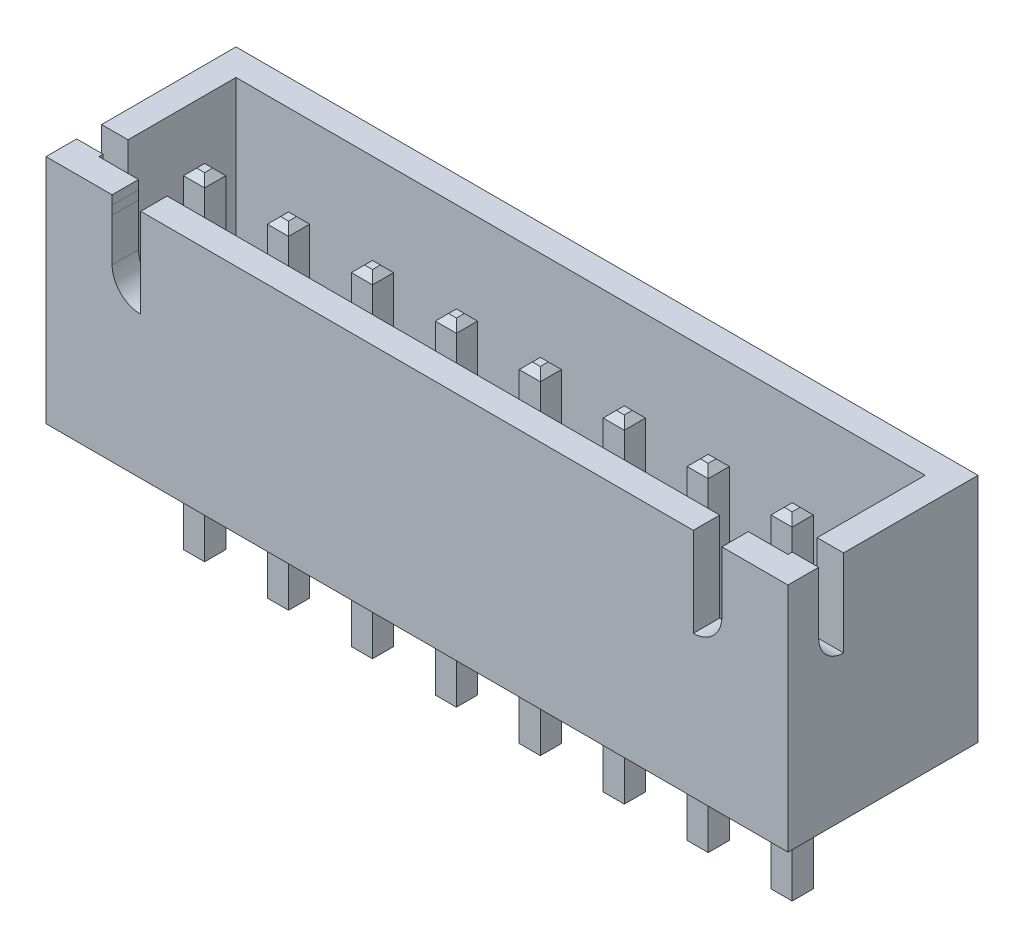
SolidWorks part; units mm, degrees
other "Camera1"
ref_plane "Front Plane" through (0, 0, 0) normal (0, 0, 1) x (1, 0, 0)
ref_plane "Top Plane" through (0, 0, 0) normal (0, 1, 0) x (1, 0, 0)
ref_plane "Right Plane" through (0, 0, 0) normal (1, 0, 0) x (0, 0, -1)
sketch "Sketch1" plane through (0, 0, 0) normal (0, 1, 0) x (1, 0, 0)
  line L1 (-11.2268, 2.875) -> (11.2268, 2.875)
  line L2 (-11.2268, 2.875) -> (-11.2268, -2.875)
  line L3 (-11.2268, -2.875) -> (11.2268, -2.875)
  line L4 (11.2268, 2.875) -> (11.2268, -2.875)
  line L5 (-11.2268, 2.875) -> (11.2268, -2.875) construction
  line L6 (-11.2268, -2.875) -> (11.2268, 2.875) construction
  point P0 (0, 0)
  dimension "D1" = 5.75
  dimension "D2" = 22.4536
extrude "Boss-Extrude1" add sketch "Sketch1" along normal blind 7
shell "Shell1" thickness 0.8
sketch "Sketch2" plane through (11.2268, 0, 0) normal (1, 0, 0) x (0, 0, -1)
  line L0 (-1.193, 7) -> (-1.193, 4.3796)
  line L1 (-2.875, 7) -> (2.875, 7) construction
  line L2 (-1.9469, 5.1335) -> (-1.9469, 7)
  line L3 (-1.9469, 7) -> (-1.193, 7)
  arc A0 (-1.193, 4.3796) -> (-1.9469, 5.1335) centre (-1.193, 5.1335) cw
extrude "Cut-Extrude1" cut sketch "Sketch2" against normal through all
sketch "Sketch3" plane through (0, 0, 2.875) normal (0, 0, 1) x (1, 0, 0)
  line L0 (-9.2268, 7) -> (-9.2268, 6.7289)
  line L1 (-11.2268, 7) -> (11.2268, 7) construction
  line L2 (-9.2268, 6.7289) -> (-9.2273, 6.7289)
  line L3 (-9.2273, 6.7289) -> (-9.2268, 6.4639)
  line L4 (-9.2268, 6.4639) -> (-9.2268, 5.1663)
  line L5 (-8.3606, 4.3001) -> (-8.3606, 7)
  line L6 (-8.3606, 7) -> (-9.2268, 7)
  line L7 (-11.2268, 7) -> (-11.2268, 0) construction
  line L8 (0, 7) -> (0, 0) construction
  line L9 (8.3606, 7) -> (9.2268, 7)
  line L10 (8.3606, 4.3001) -> (8.3606, 7)
  line L11 (9.2268, 6.4639) -> (9.2268, 5.1663)
  line L12 (9.2273, 6.7289) -> (9.2268, 6.4639)
  line L13 (9.2268, 6.7289) -> (9.2273, 6.7289)
  line L14 (9.2268, 7) -> (9.2268, 6.7289)
  arc A0 (-9.2268, 5.1663) -> (-8.3606, 4.3001) centre (-8.3606, 5.1663) ccw
  arc A1 (9.2268, 5.1663) -> (8.3606, 4.3001) centre (8.3606, 5.1663) cw
  point P23 (9.2268, 7.6815)
  point P24 (0, 0)
  point P25 (9.2273, 6.4639)
  dimension "D1" = 2
extrude "Cut-Extrude2" cut sketch "Sketch3" against normal up to next
sketch "Sketch4" plane through (0, 0, 0) normal (0, -1, 0) x (1, 0, 0)
  line L0 (-11.2268, -2.875) -> (-11.2268, 2.875) construction
  line L1 (-9.0968, 0.845) -> (-8.4568, 0.845)
  line L2 (-9.0968, 0.845) -> (-9.0968, 0.205)
  line L3 (-9.0968, 0.205) -> (-8.4568, 0.205)
  line L4 (-8.4568, 0.845) -> (-8.4568, 0.205)
  line L5 (-9.0968, 0.845) -> (-8.4568, 0.205) construction
  line L6 (-9.0968, 0.205) -> (-8.4568, 0.845) construction
  line L7 (-6.5568, 0.205) -> (-5.9168, 0.205)
  line L8 (-5.9168, 0.845) -> (-5.9168, 0.205)
  line L9 (-11.2268, 2.875) -> (11.2268, 2.875) construction
  line L10 (-6.5568, 0.845) -> (-5.9168, 0.845)
  line L11 (-6.5568, 0.845) -> (-6.5568, 0.205)
  line L12 (-4.0168, 0.205) -> (-3.3768, 0.205)
  line L13 (-3.3768, 0.845) -> (-3.3768, 0.205)
  line L14 (-4.0168, 0.845) -> (-3.3768, 0.845)
  line L15 (-4.0168, 0.845) -> (-4.0168, 0.205)
  line L16 (-1.4768, 0.205) -> (-0.8368, 0.205)
  line L17 (-0.8368, 0.845) -> (-0.8368, 0.205)
  line L18 (-1.4768, 0.845) -> (-0.8368, 0.845)
  line L19 (-1.4768, 0.845) -> (-1.4768, 0.205)
  line L20 (1.0632, 0.205) -> (1.7032, 0.205)
  line L21 (1.7032, 0.845) -> (1.7032, 0.205)
  line L22 (1.0632, 0.845) -> (1.7032, 0.845)
  line L23 (1.0632, 0.845) -> (1.0632, 0.205)
  line L24 (3.6032, 0.205) -> (4.2432, 0.205)
  line L25 (4.2432, 0.845) -> (4.2432, 0.205)
  line L26 (3.6032, 0.845) -> (4.2432, 0.845)
  line L27 (3.6032, 0.845) -> (3.6032, 0.205)
  line L28 (6.1432, 0.205) -> (6.7832, 0.205)
  line L29 (6.7832, 0.845) -> (6.7832, 0.205)
  line L30 (6.1432, 0.845) -> (6.7832, 0.845)
  line L31 (6.1432, 0.845) -> (6.1432, 0.205)
  line L32 (8.6832, 0.205) -> (9.3232, 0.205)
  line L33 (9.3232, 0.845) -> (9.3232, 0.205)
  line L34 (8.6832, 0.845) -> (9.3232, 0.845)
  line L35 (8.6832, 0.845) -> (8.6832, 0.205)
  line L40 (11.2232, 0.205) -> (11.8632, 0.205)
  line L41 (11.8632, 0.845) -> (11.8632, 0.205)
  line L42 (11.2232, 0.845) -> (11.8632, 0.845)
  line L43 (11.2232, 0.845) -> (11.2232, 0.205)
  point P0 (-8.7768, 0.525)
  dimension "D1" = 0.64
  dimension "D2" = 0.64
  dimension "D3" = 2.45
  dimension "D4" = 2.35
  dimension "D5" = 9
extrude "Boss-Extrude2" add sketch "Sketch4" along normal blind 3.45 and the other way blind 6.75
chamfer "Chamfer1" distance 0.2 angle 45 64 edges at (-8.7768, -3.45, 0.205) (-9.0968, -3.45, 0.525) (-8.7768, -3.45, 0.845) (-8.4568, -3.45, 0.525) (-8.7768, 6.75, 0.845) (-9.0968, 6.75, 0.525) (-8.7768, 6.75, 0.205) (-8.4568, 6.75, 0.525) (9.0032, 6.75, 0.845) (8.6832, 6.75, 0.525) (9.0032, 6.75, 0.205) (9.3232, 6.75, 0.525) (6.4632, 6.75, 0.845) (6.1432, 6.75, 0.525) (6.4632, 6.75, 0.205) (6.7832, 6.75, 0.525) (3.9232, 6.75, 0.845) (3.6032, 6.75, 0.525) (3.9232, 6.75, 0.205) (4.2432, 6.75, 0.525) (1.3832, 6.75, 0.845) (1.0632, 6.75, 0.525) (1.3832, 6.75, 0.205) (1.7032, 6.75, 0.525) (-1.1568, 6.75, 0.845) (-1.4768, 6.75, 0.525) (-1.1568, 6.75, 0.205) (-0.8368, 6.75, 0.525) (-3.6968, 6.75, 0.845) (-4.0168, 6.75, 0.525) (-3.6968, 6.75, 0.205) (-3.3768, 6.75, 0.525) (-6.2368, 6.75, 0.845) (-6.5568, 6.75, 0.525) (-6.2368, 6.75, 0.205) (-5.9168, 6.75, 0.525) (-6.2368, -3.45, 0.205) (-6.5568, -3.45, 0.525) (-6.2368, -3.45, 0.845) (-5.9168, -3.45, 0.525) (-3.6968, -3.45, 0.205) (-4.0168, -3.45, 0.525) (-3.6968, -3.45, 0.845) (-3.3768, -3.45, 0.525) (-1.1568, -3.45, 0.205) (-1.4768, -3.45, 0.525) (-1.1568, -3.45, 0.845) (-0.8368, -3.45, 0.525) (1.3832, -3.45, 0.205) (1.0632, -3.45, 0.525) (1.3832, -3.45, 0.845) (1.7032, -3.45, 0.525) (3.9232, -3.45, 0.205) (3.6032, -3.45, 0.525) (3.9232, -3.45, 0.845) (4.2432, -3.45, 0.525) (6.4632, -3.45, 0.205) (6.1432, -3.45, 0.525) (6.4632, -3.45, 0.845) (6.7832, -3.45, 0.525) (9.0032, -3.45, 0.205) (8.6832, -3.45, 0.525) (9.0032, -3.45, 0.845) (9.3232, -3.45, 0.525)
